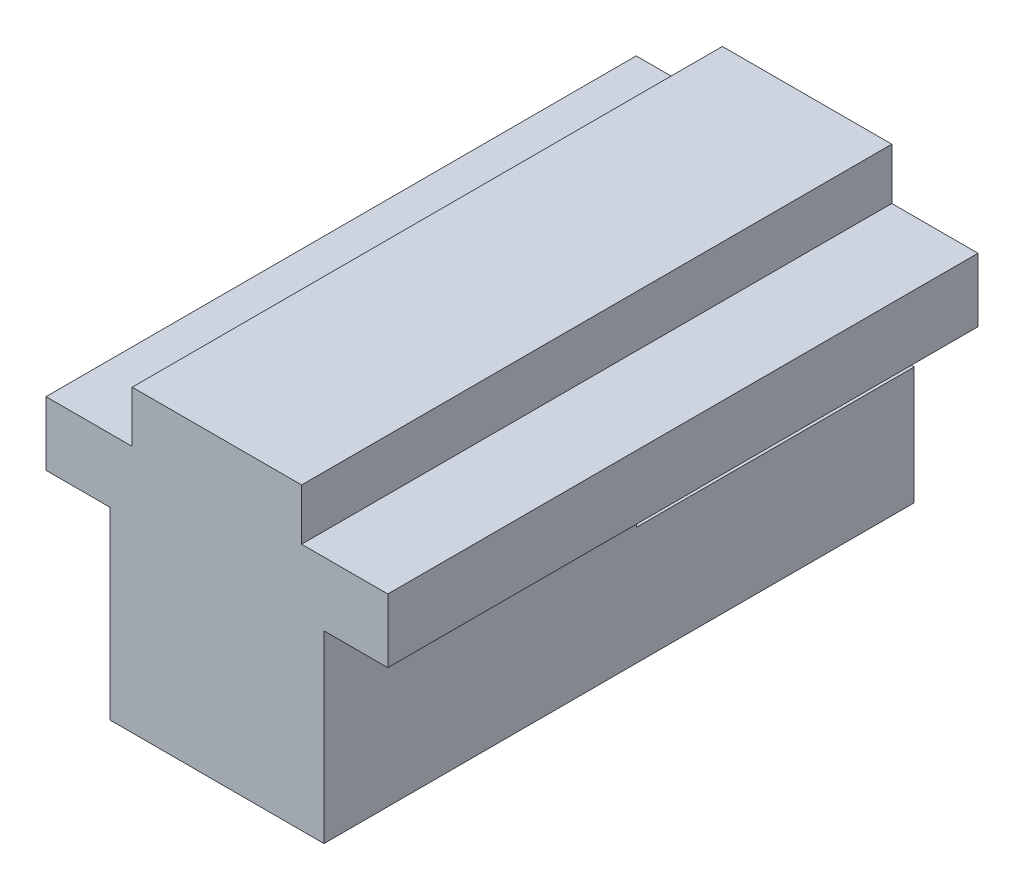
SolidWorks part; units mm, degrees
ref_plane "Front Plane" through (0, 0, 0) normal (0, 0, 1) x (1, 0, 0)
ref_plane "Top Plane" through (0, 0, 0) normal (0, 1, 0) x (1, 0, 0)
ref_plane "Right Plane" through (0, 0, 0) normal (1, 0, 0) x (0, 0, -1)
sketch "Sketch2" plane through (0, 0, 0) normal (0, 0, 1) x (1, 0, 0)
  line L0 (20.6375, 0) -> (25.3746, 0)
  line L1 (0, 0) -> (4.7625, 0)
  line L2 (0, 0) -> (0, 4.7371)
  line L3 (0, 4.7371) -> (6.4008, 4.7371)
  line L4 (25.3746, 0) -> (25.3746, 4.7371)
  line L5 (18.9738, 4.7371) -> (25.3746, 4.7371)
  line L6 (4.7625, 0) -> (4.7625, -13.6779)
  line L7 (4.7625, -13.6779) -> (20.6375, -13.6779)
  line L8 (20.6375, 0) -> (20.6375, -13.6779)
  line L9 (15.9258, 8.5471) -> (18.9738, 8.5471)
  line L10 (6.4008, 4.7371) -> (6.4008, 8.5471)
  line L11 (6.4008, 8.5471) -> (9.4488, 8.5471)
  line L12 (18.9738, 4.7371) -> (18.9738, 8.5471)
  line L13 (9.4488, 8.5471) -> (15.9258, 8.5471)
  dimension "D1" = 4.7371
  dimension "D2" = 25.3746
  dimension "D3" = 15.875
  dimension "D4" = 13.6779
  dimension "D5" = 12.573
  dimension "D6" = 1.6383
  dimension "D8" = 3.81
  dimension "D13" = 22.225
  dimension "D14" = 90
extrude "Boss-Extrude1" add sketch "Sketch2" against normal blind 43.815
sketch "Sketch3" plane through (0, -13.6779, 0) normal (0, -1, 0) x (1, 0, 0)
  line L1 (4.7625, -43.815) -> (4.7625, 0) construction
  line L2 (4.7625, -43.815) -> (20.6375, -43.815) construction
  line L4 (4.7625, 0) -> (20.6375, 0) construction
  circle A0 centre (7.9375, -12.065) radius 1.6002
  circle A1 centre (17.4625, -12.065) radius 1.6002
  dimension "D1" = 3.2004
  dimension "D2" = 3.2004
  dimension "D5" = 31.75
  dimension "D6" = 12.065
  dimension "D3" = 9.525
  dimension "D4" = 3.175
  dimension "D7" = 12.065
extrude "Cut-Extrude1" cut sketch "Sketch3" against normal blind 6.35
hole_wizard "#10-32 Tapped Hole1" positions "Sketch4" profile "Sketch5" tap size "#10-32" standard "ANSI Inch"
sketch "Sketch4" plane through (0, -13.6779, 0) normal (0, -1, 0) x (-1, 0, 0)
  line L1 (-4.7625, 0) -> (-20.6375, 0) construction
  circle A1 centre (-7.9375, 12.065) radius 1.6002 construction
  point P0 (-12.878, 4.1275)
  point P2 (-12.878, 20.0025)
  point P14 (-7.2284, 0)
  dimension "D2" = 7.9375
  dimension "D1" = 20.0025
sketch "Sketch5" plane through (12.878, -13.6779, -4.1275) normal (1, 0, 0) x (0, 0, -1)
  line L0 (0, 0) -> (0, 13.1513)
  line L1 (0, 13.1513) -> (2.0193, 11.938)
  line L2 (2.0193, 11.938) -> (2.0193, 1.0287)
  line L3 (2.0193, 1.0287) -> (3.048, 0)
  line L5 (3.048, 0) -> (0, 0)
  line L6 (-2.0193, 1.0287) -> (-3.048, 0) construction
  line L10 (0, 13.1513) -> (-2.0193, 11.938) construction
  line L11 (0, -6.35) -> (0, 107.95) construction
  dimension "Tap Drill Dia." = 4.0386
  dimension "Tap Drill Depth" = 11.938
  dimension "Near C'Sink Dia." = 6.096
  dimension "Near C'Sink Angle" = 90
  dimension "Drill Angle" = 118
sketch "Sketch6" plane through (4.7625, 0, 0) normal (-1, 0, 0) x (0, 0, 1)
  line L0 (-43.815, 0) -> (-43.815, -13.6779) construction
  line L1 (-43.815, 0.0127) -> (-23.1902, 0.0127)
  line L2 (-43.815, 0.0127) -> (-43.815, -4.9403)
  line L3 (-43.815, -4.9403) -> (-23.1902, -4.9403)
  line L4 (-23.1902, 0.0127) -> (-23.1902, -4.9403)
  line L5 (-43.815, 8.5471) -> (0, 8.5471) construction
  dimension "D1" = 20.6248
  dimension "D2" = 4.953
  dimension "D3" = 8.5344
extrude "Cut-Extrude2" cut sketch "Sketch6" against normal through all both and the other way through all
